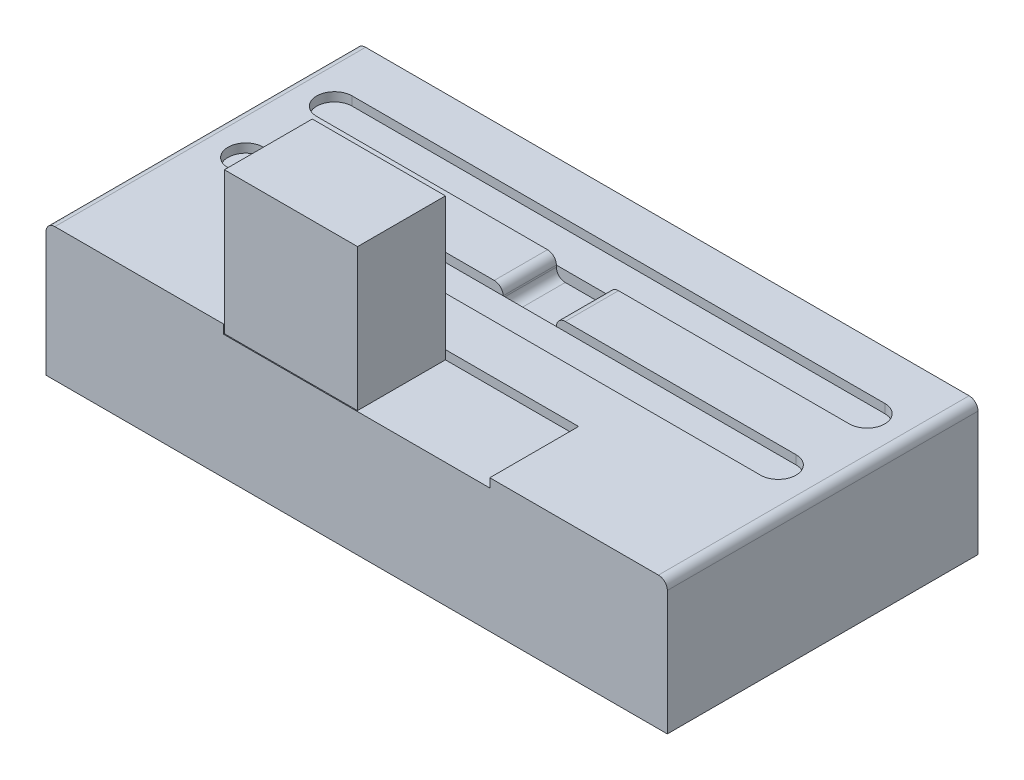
SolidWorks part; units mm, degrees
ref_plane "Plan de face" through (0, 0, 0) normal (0, 0, 1) x (1, 0, 0)
ref_plane "Plan de dessus" through (0, 0, 0) normal (0, 1, 0) x (1, 0, 0)
ref_plane "Plan de droite" through (0, 0, 0) normal (1, 0, 0) x (0, 0, -1)
sketch "Esquisse1" plane through (0, 0, 0) normal (0, 1, 0) x (1, 0, 0)
  line L1 (3.5, -1.75) -> (-3.5, -1.75)
  line L2 (3.5, -1.75) -> (3.5, 1.75)
  line L3 (3.5, 1.75) -> (-3.5, 1.75)
  line L4 (-3.5, -1.75) -> (-3.5, 1.75)
  line L5 (3.5, -1.75) -> (-3.5, 1.75) construction
  line L6 (3.5, 1.75) -> (-3.5, -1.75) construction
  point P0 (0, 0)
  dimension "D1" = 7
  dimension "D2" = 3.5
extrude "Boss.-Extru.1" add sketch "Esquisse1" along normal blind 1.5
sketch "Esquisse2" plane through (0, 1.5, 0) normal (0, 1, 0) x (1, 0, 0)
  line L0 (-4.0953, 0) -> (4.0651, 0) construction
  line L1 (0, -2.0269) -> (0, 1.9892) construction
  line L2 (-3.5, -1.75) -> (3.5, -1.75) construction
  line L3 (1.5, -1.75) -> (-1.5, -1.75)
  line L4 (1.5, -1.75) -> (1.5, -0.75)
  line L5 (1.5, -0.75) -> (-1.5, -0.75)
  line L6 (-1.5, -1.75) -> (-1.5, -0.75)
  line L7 (1.5, -1.75) -> (-1.5, -0.75) construction
  line L8 (1.5, -0.75) -> (-1.5, -1.75) construction
  line L9 (-3, 0) -> (3, 0) construction
  line L10 (-3, 0.2) -> (3, 0.2)
  line L11 (-3, -0.2) -> (3, -0.2)
  line L12 (-3.0762, 0.5) -> (3.4386, 0.5) construction
  line L13 (-3, 1) -> (3, 1) construction
  line L14 (-3, 0.8) -> (3, 0.8)
  line L15 (-3, 1.2) -> (3, 1.2)
  arc A0 (-3, 0.2) -> (-3, -0.2) centre (-3, 0) ccw
  arc A1 (3, -0.2) -> (3, 0.2) centre (3, 0) ccw
  arc A2 (-3, 0.8) -> (-3, 1.2) centre (-3, 1) cw
  arc A3 (3, 1.2) -> (3, 0.8) centre (3, 1) cw
  point P5 (0, -1.25)
  point P14 (0, 0)
  point P23 (0, 1)
  dimension "D1" = 1
  dimension "D2" = 3
  dimension "D4" = 0.5
  dimension "D5" = 6
extrude "Enlèv. mat.-Extru.1" cut sketch "Esquisse2" against normal blind 0.1
sketch "Esquisse3" plane through (0, 1.4, 0) normal (0, 1, 0) x (1, 0, 0)
  line L0 (1.5, -0.75) -> (-1.5, -0.75) construction
  line L1 (-1.5, -1.74) -> (0, -1.74)
  line L2 (-1.5, -1.74) -> (-1.5, -0.75)
  line L3 (-1.5, -0.75) -> (0, -0.75)
  line L4 (0, -1.74) -> (0, -0.75)
  dimension "D1" = 1.5
  dimension "D2" = 0.99
extrude "Boss.-Extru.2" add sketch "Esquisse3" along normal blind 1.6
sketch "Esquisse4" plane through (0, 1.5, 0) normal (0, 1, 0) x (1, 0, 0)
  line L0 (0, -0.4341) -> (0, 1.9665) construction
  line L1 (-3, 0.8) -> (3, 0.8) construction
  line L2 (-0.3, 0.8) -> (0.3, 0.8)
  line L3 (-0.3, 0.8) -> (-0.3, 0.2)
  line L4 (-0.3, 0.2) -> (0.3, 0.2)
  line L5 (0.3, 0.8) -> (0.3, 0.2)
  line L6 (3, 0.2) -> (-3, 0.2) construction
  dimension "D1" = 0.6
extrude "Enlèv. mat.-Extru.2" cut sketch "Esquisse4" against normal blind 0.22
fillet "Congé2" radius 0.1 4 edges at (0.3, 1.5, -0.5) (0.3, 1.28, -0.5) (-0.3, 1.28, -0.5) (-0.3, 1.5, -0.5)
fillet "Congé3" radius 0.1 2 edges at (3.5, 1.5, 0) (-3.5, 1.5, 0)
